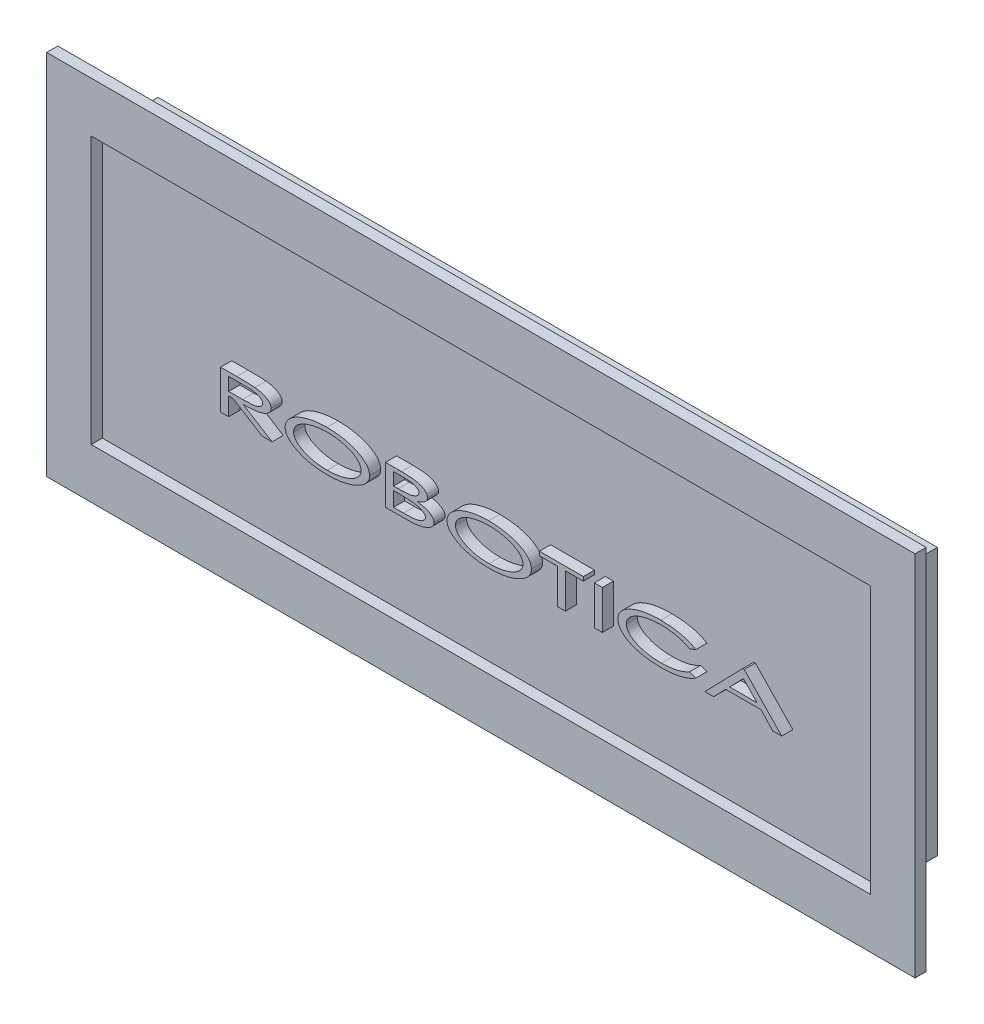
SolidWorks part; units mm, degrees
ref_plane "Alzado" through (0, 0, 0) normal (0, 0, 1) x (1, 0, 0)
ref_plane "Planta" through (0, 0, 0) normal (0, 1, 0) x (1, 0, 0)
ref_plane "Vista lateral" through (0, 0, 0) normal (1, 0, 0) x (0, 0, -1)
sketch "Croquis1" plane through (0, 0, 0) normal (0, 0, 1) x (1, 0, 0)
  line L1 (-35, 12) -> (35, 12)
  line L2 (-35, 12) -> (-35, -12)
  line L3 (-35, -12) -> (35, -12)
  line L4 (35, 12) -> (35, -12)
  line L5 (-35, 12) -> (35, -12) construction
  line L6 (-35, -12) -> (35, 12) construction
  point P0 (0, 0)
  dimension "D1" = 24
  dimension "D2" = 70
extrude "Saliente-Extruir1" add sketch "Croquis1" along normal blind 5
sketch "Croquis2" plane through (0, 0, 5) normal (0, 0, 1) x (1, 0, 0)
  text T0 "ROBOTICA" font "Century Gothic" height 3.5
extrude "Saliente-Extruir2" add sketch "Croquis2" along normal blind 1
sketch "Croquis3" plane through (0, 0, 5) normal (0, 0, 1) x (1, 0, 0)
  line L1 (-39, 16.5) -> (39, 16.5)
  line L2 (-39, 16.5) -> (-39, -16.5)
  line L3 (-39, -16.5) -> (39, -16.5)
  line L4 (39, 16.5) -> (39, -16.5)
  line L5 (-39, 16.5) -> (39, -16.5) construction
  line L6 (-39, -16.5) -> (39, 16.5) construction
  line L7 (-35, 12) -> (35, 12)
  line L8 (-35, 12) -> (-35, -12)
  line L9 (-35, -12) -> (35, -12)
  line L10 (35, 12) -> (35, -12)
  line L11 (-35, 12) -> (35, -12) construction
  line L12 (-35, -12) -> (35, 12) construction
  point P0 (0, 0)
  point P6 (0, 0)
  dimension "D1" = 33
  dimension "D2" = 78
extrude "Saliente-Extruir3" add sketch "Croquis3" along normal blind 1
